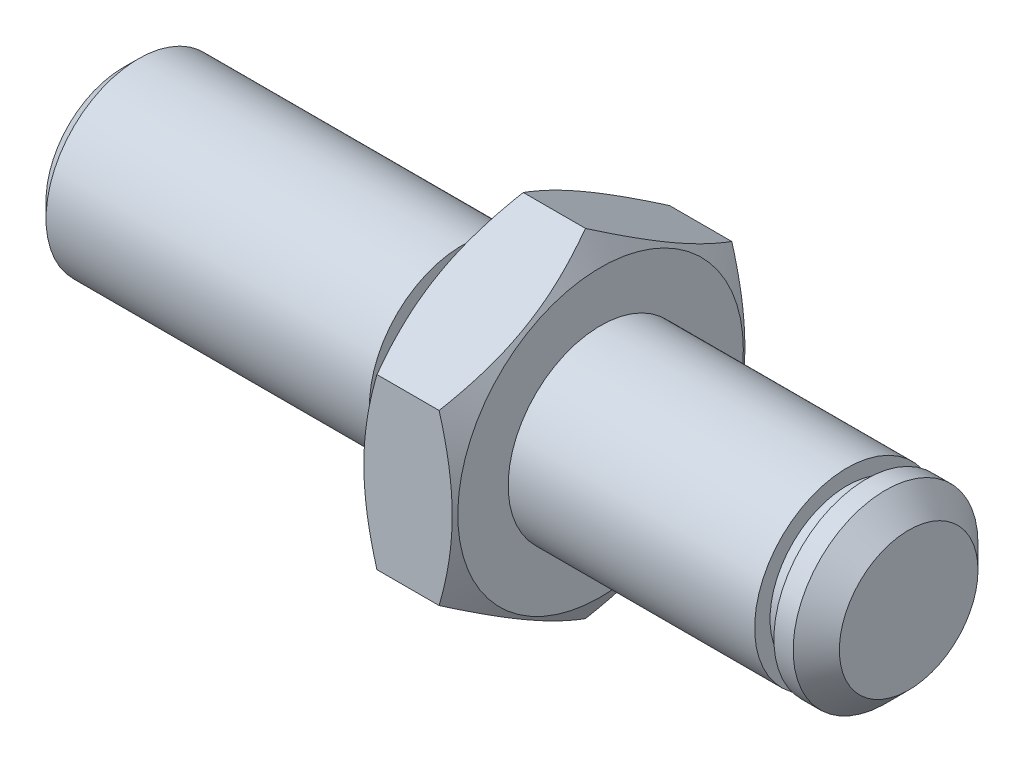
SolidWorks part; units mm, degrees
ref_plane "Face" through (0, 0, 0) normal (0, 0, 1) x (1, 0, 0)
ref_plane "Dessus" through (0, 0, 0) normal (0, 1, 0) x (1, 0, 0)
ref_plane "Droite" through (0, 0, 0) normal (1, 0, 0) x (0, 0, -1)
sketch "Esquisse1" plane through (0, 0, 0) normal (0, 0, 1) x (1, 0, 0)
  line L0 (1, 6) -> (22, 6)
  line L1 (0, 0) -> (51, 0)
  line L2 (0, 0) -> (0, 5)
  line L3 (26, 11) -> (30, 11)
  line L4 (51, 0) -> (51, 4.5)
  line L5 (22, 6) -> (22, 5)
  line L6 (22, 5) -> (25, 5)
  line L7 (25, 5) -> (25, 9.2679)
  line L8 (31, 9.2679) -> (31, 6)
  line L9 (31, 6) -> (47, 6)
  line L10 (47, 6) -> (47, 5)
  line L11 (47, 5) -> (48.25, 5)
  line L12 (48.25, 5) -> (48.25, 6)
  line L13 (48.25, 6) -> (49.5, 6)
  line L14 (49.5, 6) -> (51, 4.5)
  line L15 (0, 5) -> (1, 6)
  line L16 (30, 11) -> (31, 9.2679)
  line L17 (25, 9.2679) -> (26, 11)
  line L18 (0, 0) -> (-20, 0) construction
  point P5 (0, 6)
  point P9 (25, 11)
  point P10 (31, 11)
  dimension "D1" = 3
  dimension "D2" = 25
  dimension "D3" = 5
  dimension "D4" = 6
  dimension "D7" = 1
  dimension "D5" = 16
  dimension "D6" = 1.25
  dimension "D8" = 1
  dimension "D9" = 45
  dimension "D10" = 1.5
  dimension "D11" = 20
  dimension "D12" = 51
  dimension "D13" = 6
  dimension "D14" = 11
  dimension "D15" = 1
  dimension "D16" = 30
  dimension "D17" = 1
  dimension "D18" = 60
revolve "Base-Révolution" add sketch "Esquisse1" angle 360 about L18
sketch "Esquisse2" plane through (31, 0, 0) normal (1, 0, 0) x (0, 0, -1)
  line L1 (9.5, -5.4848) -> (9.5, 5.4848)
  line L2 (9.5, 5.4848) -> (0, 10.9697)
  line L3 (0, 10.9697) -> (-9.5, 5.4848)
  line L4 (-9.5, 5.4848) -> (-9.5, -5.4848)
  line L5 (-9.5, -5.4848) -> (0, -10.9697)
  line L6 (0, -10.9697) -> (9.5, -5.4848)
  circle A0 centre (0, 0) radius 9.5 construction
  circle A1 centre (0, 0) radius 11 construction
  circle A2 centre (0, 0) radius 11
  dimension "D1" = 19
extrude "Enlèv. mat.-Extru.1" cut sketch "Esquisse2" against normal through all
